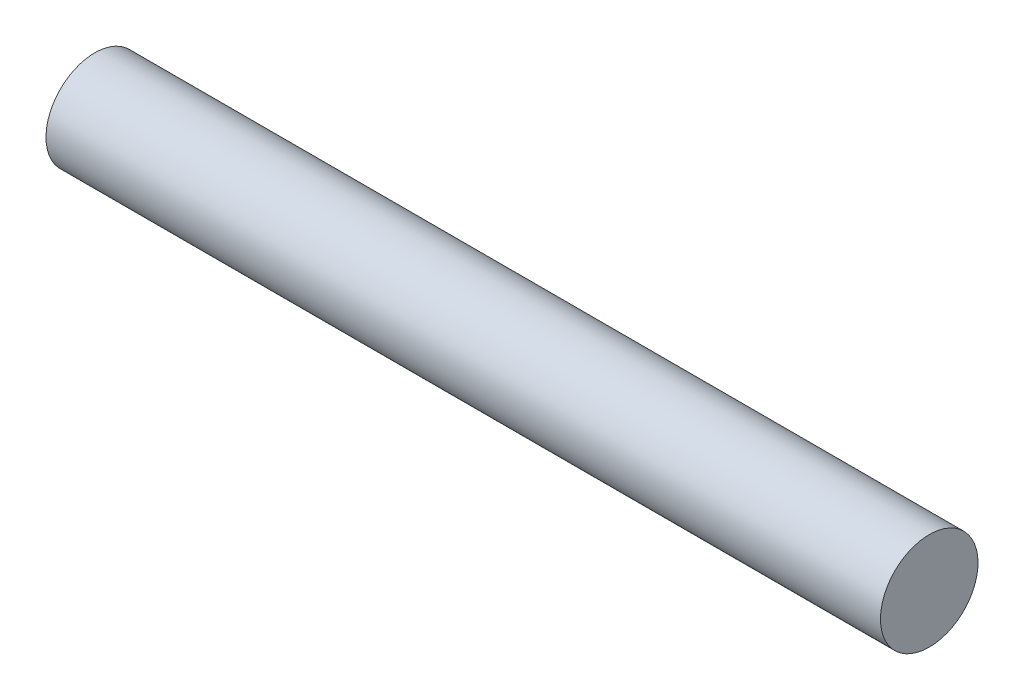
SolidWorks part; units mm, degrees
ref_plane "Front Plane" through (0, 0, 0) normal (0, 0, 1) x (1, 0, 0)
ref_plane "Top Plane" through (0, 0, 0) normal (0, 1, 0) x (1, 0, 0)
ref_plane "Right Plane" through (0, 0, 0) normal (1, 0, 0) x (0, 0, -1)
sketch "Sketch1" plane through (0, 0, 0) normal (0, 0, 1) x (1, 0, 0)
  line L0 (0, 0) -> (0, 3.3782)
  line L1 (0, 3.3782) -> (57.785, 3.3782)
  line L2 (57.785, 3.3782) -> (57.785, 0)
  line L3 (57.785, 0) -> (0, 0)
  line L4 (57.785, 0) -> (0, 0) construction
  dimension "D1" = 3.3782
  dimension "D2" = 57.785
revolve "Revolve1" add sketch "Sketch1" angle 360 about L4
